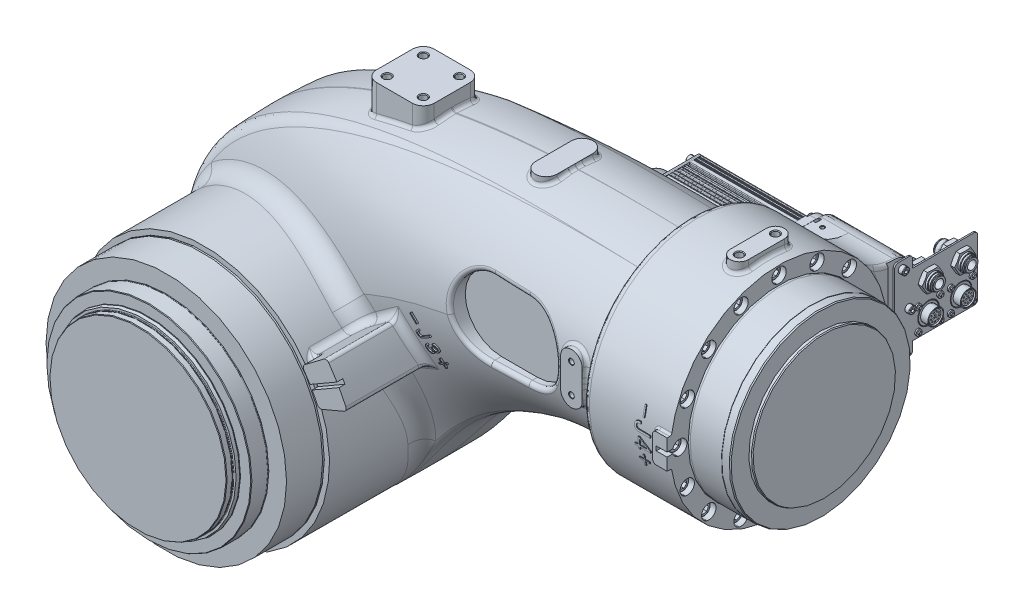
SolidWorks part; units mm, degrees
ref_plane "前视基准面" through (0, 0, 0) normal (0, 0, 1) x (1, 0, 0)
ref_plane "上视基准面" through (0, 0, 0) normal (0, 1, 0) x (1, 0, 0)
ref_plane "右视基准面" through (0, 0, 0) normal (1, 0, 0) x (0, 0, -1)
imported_body "肘部装配E-1-solid1"
sketch "草图1" plane through (0, 0, 12.5) normal (0, 0, -1) x (-1, 0, 0)
  line L1 (93.0407, -294.1524) -> (-93.0407, -294.1524)
  line L2 (93.0407, -294.1524) -> (93.0407, -105.8476)
  line L3 (93.0407, -105.8476) -> (-93.0407, -105.8476)
  line L4 (-93.0407, -294.1524) -> (-93.0407, -105.8476)
  line L5 (93.0407, -294.1524) -> (-93.0407, -105.8476) construction
  line L6 (93.0407, -105.8476) -> (-93.0407, -294.1524) construction
  point P0 (0, -200)
surface "曲面-基准面1" sketch "草图1"
split "分割1" trim tools "曲面-基准面1" bodies to split 122 resulting bodies 124 125
sketch "草图2" plane through (483.4, 0, 0) normal (-1, 0, 0) x (0, 0, 1)
  line L1 (-55.5415, -67.1909) -> (-191.2085, -67.1909)
  line L2 (-55.5415, -67.1909) -> (-55.5415, 67.1909)
  line L3 (-55.5415, 67.1909) -> (-191.2085, 67.1909)
  line L4 (-191.2085, -67.1909) -> (-191.2085, 67.1909)
  line L5 (-55.5415, -67.1909) -> (-191.2085, 67.1909) construction
  line L6 (-55.5415, 67.1909) -> (-191.2085, -67.1909) construction
  point P0 (-123.375, 0)
surface "曲面-基准面2" sketch "草图2"
split "分割2" trim tools "曲面-基准面2" bodies to split 124 125 resulting bodies 127 128 129
